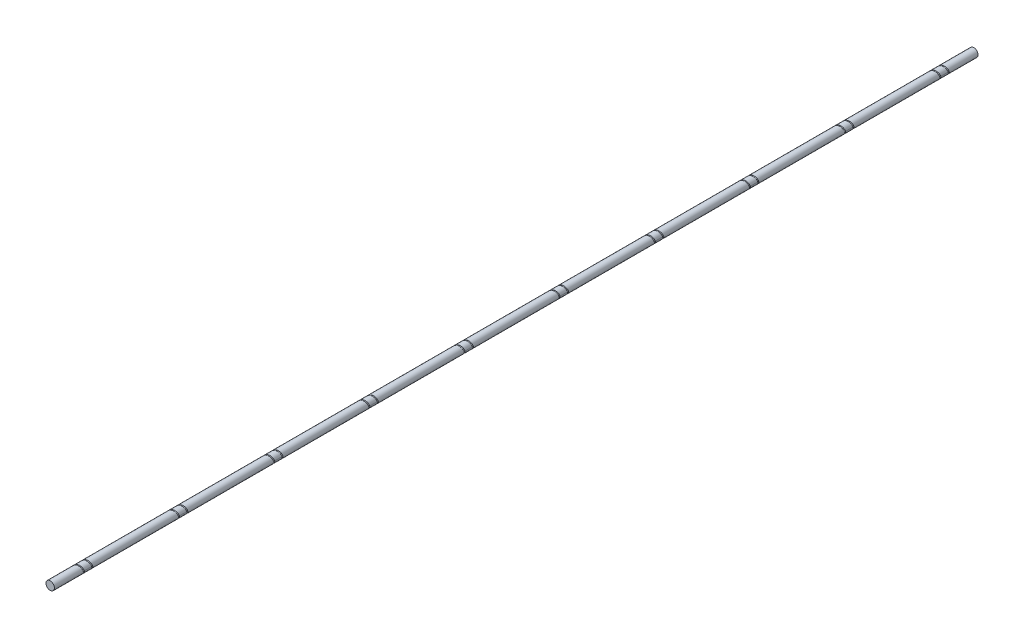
SolidWorks part; units mm, degrees
ref_plane "Front Plane" through (0, 0, 0) normal (0, 0, 1) x (1, 0, 0)
ref_plane "Top Plane" through (0, 0, 0) normal (0, 1, 0) x (1, 0, 0)
ref_plane "Right Plane" through (0, 0, 0) normal (1, 0, 0) x (0, 0, -1)
sketch "Sketch1" plane through (0, 0, 0) normal (0, 0, 1) x (1, 0, 0)
  circle A0 centre (0, 0) radius 25
  dimension "D1" = 50
extrude "Boss-Extrude1" add sketch "Sketch1" along normal blind 5500
ref_plane "Plane1" through (0, 0, 150) normal (0, 0, 1) x (1, 0, 0)
sketch "Sketch2" plane through (0, 0, 150) normal (0, 0, 1) x (1, 0, 0)
  circle A0 centre (0, 0) radius 27.646
  dimension "D1" = 55.292
curve "Helix/Spiral1"
sketch "Sketch3" plane through (0, 0, 0) normal (0, 1, 0) x (1, 0, 0)
  circle A0 centre (-27.646, -150) radius 3.969
  spline S0 degree 3 poles (-27.646, -150) (-27.646, -150.7073) (-26.9833, -152.1286) (-24.0718, -154.2551) (-19.4496, -156.383) (-13.4454, -158.5106) (-6.4857, -160.6383) (0.9349, -162.766) (8.289, -164.8936) (15.0541, -167.0213) (20.7495, -169.1489) (24.9703, -171.2766) (27.4167, -173.4043) (27.9149, -175.5319) (26.4293, -177.6596) (23.0657, -179.7872) (18.063, -181.9149) (11.7766, -184.0426) (4.6535, -186.1702) (-2.8004, -188.2979) (-10.0553, -190.4255) (-16.5956, -192.5532) (-21.9566, -194.6809) (-25.7573, -196.8085) (-27.7277, -198.9362) (-27.7277, -201.0638) (-25.7573, -203.1915) (-21.9566, -205.3191) (-16.5956, -207.4468) (-10.0553, -209.5745) (-2.8004, -211.7021) (4.6535, -213.8298) (11.7766, -215.9574) (18.063, -218.0851) (23.0657, -220.2128) (26.4293, -222.3404) (27.9149, -224.4681) (27.4167, -226.5957) (24.9703, -228.7234) (20.7495, -230.8511) (15.0541, -232.9787) (8.289, -235.1064) (0.9349, -237.234) (-6.4857, -239.3617) (-13.4454, -241.4894) (-19.4496, -243.617) (-24.0718, -245.7449) (-26.9833, -247.8714) (-27.646, -249.2927) (-27.646, -250) knots 0 0 0 0 0.021277 0.042553 0.06383 0.085106 0.106383 0.12766 0.148936 0.170213 0.191489 0.212766 0.234043 0.255319 0.276596 0.297872 0.319149 0.340426 0.361702 0.382979 0.404255 0.425532 0.446809 0.468085 0.489362 0.510638 0.531915 0.553191 0.574468 0.595745 0.617021 0.638298 0.659574 0.680851 0.702128 0.723404 0.744681 0.765957 0.787234 0.808511 0.829787 0.851064 0.87234 0.893617 0.914894 0.93617 0.957447 0.978723 1 1 1 1 construction
  dimension "D1" = 7.938
sweep "Cut-Sweep1" cut profiles "Sketch3" path "Helix/Spiral1"
pattern_linear "LPattern1" count 10 spacing 566.6667 along (0, 0, -1) of "Cut-Sweep1"
